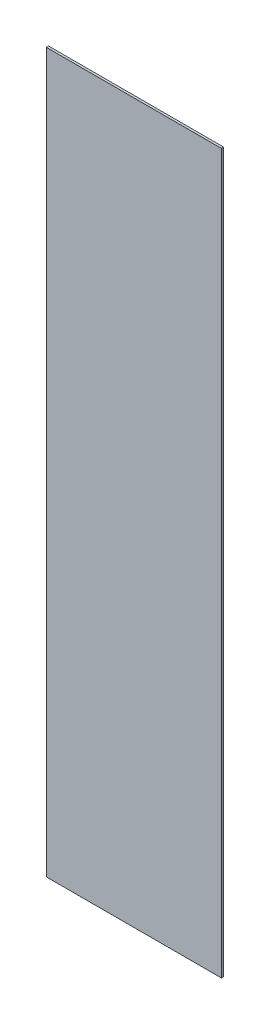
SolidWorks part; units mm, degrees
ref_plane "Front Plane" through (0, 0, 0) normal (0, 0, 1) x (1, 0, 0)
ref_plane "Top Plane" through (0, 0, 0) normal (0, 1, 0) x (1, 0, 0)
ref_plane "Right Plane" through (0, 0, 0) normal (1, 0, 0) x (0, 0, -1)
sketch "Sketch1" plane through (0, 0, 0) normal (0, 0, 1) x (1, 0, 0)
  line L0 (79.375, 254) -> (79.375, -254) construction
  line L1 (79.375, 254) -> (-44.45, 254)
  line L2 (79.375, 254) -> (79.375, -254)
  line L3 (79.375, -254) -> (-44.45, -254)
  line L4 (-44.45, 254) -> (-44.45, -254)
  line L5 (-76.2, -254) -> (76.2, -254) construction
  line L6 (-44.45, -127) -> (-44.45, -252.4125) construction
  line L7 (76.2, 254) -> (-76.2, 254) construction
extrude "Extrude1" add sketch "Sketch1" along normal blind 1.5875
